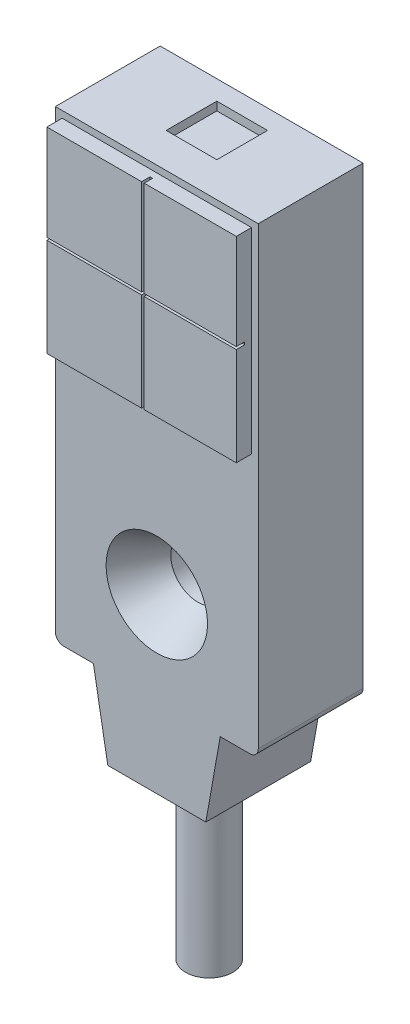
SolidWorks part; units mm, degrees
other "细节项目1"
ref_plane "前视基准面" through (0, 0, 0) normal (0, 0, 1) x (1, 0, 0)
ref_plane "上视基准面" through (0, 0, 0) normal (0, 1, 0) x (1, 0, 0)
ref_plane "右视基准面" through (0, 0, 0) normal (1, 0, 0) x (0, 0, -1)
sketch "草图1" plane through (0, 0, 0) normal (0, 0, 1) x (1, 0, 0)
  line L0 (0, 0.5) -> (0, 27.4)
  line L1 (0, 27.4) -> (12, 27.4)
  line L2 (12, 27.4) -> (12, 0.5)
  line L5 (6, -4.8) -> (8.9, -4.8)
  line L6 (6, -4.8) -> (3.1, -4.8)
  line L8 (3.1, -4.8) -> (2.25, 0)
  line L9 (0.5, 0) -> (2.25, 0)
  line L11 (8.9, -4.8) -> (9.75, 0)
  line L12 (11.5, 0) -> (9.75, 0)
  arc A0 (0, 0.5) -> (0.5, 0) centre (0.5, 0.5) ccw
  arc A1 (12, 0.5) -> (11.5, 0) centre (11.5, 0.5) cw
  point P9 (0, 0)
  dimension "D1" = 0.5
extrude "凸台-拉伸1" add sketch "草图1" along normal blind 6.2
sketch "草图2" plane through (0, 0, 6.2) normal (0, 0, 1) x (1, 0, 0)
  line L3 (0.4, 27) -> (11.6, 27)
  line L4 (11.6, 27) -> (11.6, 15.4)
  line L5 (11.6, 15.4) -> (0.4, 15.4)
  line L6 (0.4, 15.4) -> (0.4, 27)
extrude "凸台-拉伸2" add sketch "草图2" along normal blind 0.9
sketch "草图4" plane through (0, 0, 7.1) normal (0, 0, 1) x (1, 0, 0)
  line L0 (6, 27) -> (6, 21.35)
  line L7 (11.6, 27) -> (0.4, 27) construction
  line L8 (0.4, 15.4) -> (11.6, 15.4) construction
  line L9 (6, 27) -> (6.15, 27)
  line L11 (11.6, 21.2) -> (6.15, 21.2)
  line L13 (11.6, 27) -> (0.4, 27) construction
  line L14 (6.15, 27) -> (6.15, 21.35)
  line L15 (0.4, 15.4) -> (11.6, 15.4) construction
  line L16 (6.15, 15.4) -> (6, 15.4)
  line L17 (0.4, 21.2) -> (0.4, 21.35)
  line L19 (0.4, 21.35) -> (6, 21.35)
  line L20 (11.6, 21.35) -> (11.6, 21.2)
  line L21 (6.15, 21.2) -> (6.15, 15.4)
  line L22 (6, 21.2) -> (0.4, 21.2)
  line L23 (6, 21.2) -> (6, 15.4)
  line L24 (6.15, 21.35) -> (11.6, 21.35)
extrude "切除-拉伸2" cut sketch "草图4" against normal blind 0.5
sketch "草图5" plane through (0, 27.4, 0) normal (0, 1, 0) x (1, 0, 0)
  line L4 (6, -1.15) -> (4.5, -1.15)
  line L5 (4.5, -1.15) -> (4.5, -4.15)
  line L6 (4.5, -4.15) -> (7.5, -4.15)
  line L7 (7.5, -4.15) -> (7.5, -1.15)
  line L8 (7.5, -1.15) -> (6, -1.15)
extrude "切除-拉伸3" cut sketch "草图5" against normal blind 0.5
sketch "草图6" plane through (0, 0, 6.2) normal (0, 0, 1) x (1, 0, 0)
  line L0 (12, 27.4) -> (12, 5.4)
  line L1 (12, 0.5) -> (12, 27.4) construction
  circle A0 centre (6, 5.4) radius 1.6
extrude "切除-拉伸4" cut sketch "草图6" against normal blind 6.2 contours A0
sketch "草图12" plane through (0, 0, 6.2) normal (0, 0, 1) x (1, 0, 0)
  circle A1 centre (6, 5.4) radius 2.1334
extrude "凸台-拉伸3" add sketch "草图12" against normal blind 6.2
sketch "草图13" plane through (0, 0, 6.2) normal (0, 0, 1) x (1, 0, 0)
  circle A0 centre (6, 5.4) radius 1.6
extrude "切除-拉伸6" cut sketch "草图13" against normal blind 2 contours A0
sketch "草图17" plane through (0, 0, 6.2) normal (0, 0, 1) x (1, 0, 0)
  circle A0 centre (6, 5.4) radius 1.6
extrude "切除-拉伸12" cut sketch "草图17" against normal blind 6.2
chamfer "倒角4" distance 1.4 angle 60 1 edges at (7.6, 5.4, 6.2)
sketch "草图18" plane through (0, -4.8, 0) normal (0, -1, 0) x (1, 0, 0)
  circle A0 centre (6, 3.1) radius 1.4
extrude "凸台-拉伸5" add sketch "草图18" along normal blind 10 contours A0
